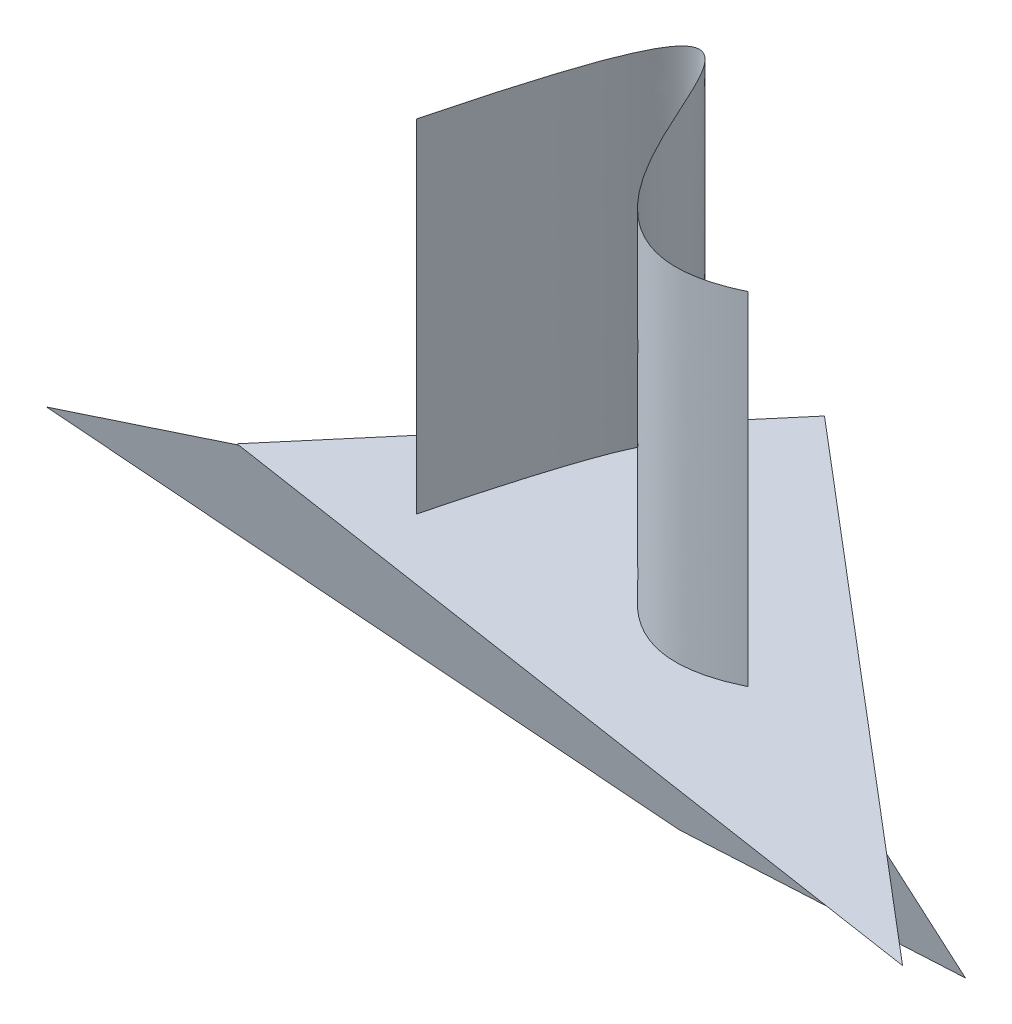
SolidWorks part; units mm, degrees
ref_plane "Front Plane" through (0, 0, 0) normal (0, 0, 1) x (1, 0, 0)
ref_plane "Top Plane" through (0, 0, 0) normal (0, 1, 0) x (1, 0, 0)
ref_plane "Right Plane" through (0, 0, 0) normal (1, 0, 0) x (0, 0, -1)
sketch "Sketch1" plane through (0, 0, 0) normal (0, 1, 0) x (1, 0, 0)
  line L0 (-76.0637, -8.1497) -> (0, 81.4969)
  line L1 (0, 81.4969) -> (145.258, -41.7524)
  line L2 (145.258, -41.7524) -> (-76.0637, -8.1497)
surface "Surface-Plane1" sketch "Sketch1"
ref_plane "Plane1" through (0, 96.52, 0) normal (0, 1, 0) x (1, 0, 0)
sketch "Sketch2" plane through (0, 96.52, 0) normal (0, 1, 0) x (1, 0, 0)
  spline S0 degree 3 poles (-33.5743, 0) (2.5244, 140.6176) (-10.6067, -27.6706) (55.3213, 4.6018) knots 0 0 0 0 1 1 1 1
ref_plane "Plane2" through (-0.9618, -9.1503, 6.3345) normal (0.0861, 0.8192, -0.5671) x (0.9887, 0, 0.1501)
sketch "Sketch3" plane through (-0.9618, -9.1503, 6.3345) normal (0.0861, 0.8192, -0.5671) x (0.9887, 0, 0.1501)
  line L0 (-79.2261, 19.2586) -> (26.7272, 72.2353)
  line L1 (26.7272, 72.2353) -> (146.1655, 6.4158)
  line L2 (146.1655, 6.4158) -> (101.2156, -39.8184)
  line L3 (101.2156, -39.8184) -> (-62.2094, -84.1261)
  line L4 (-62.2094, -84.1261) -> (-79.2261, 19.2586)
surface "Surface-Plane2" sketch "Sketch3"
surface "Surface-Extrude1" sketch "Sketch2"
